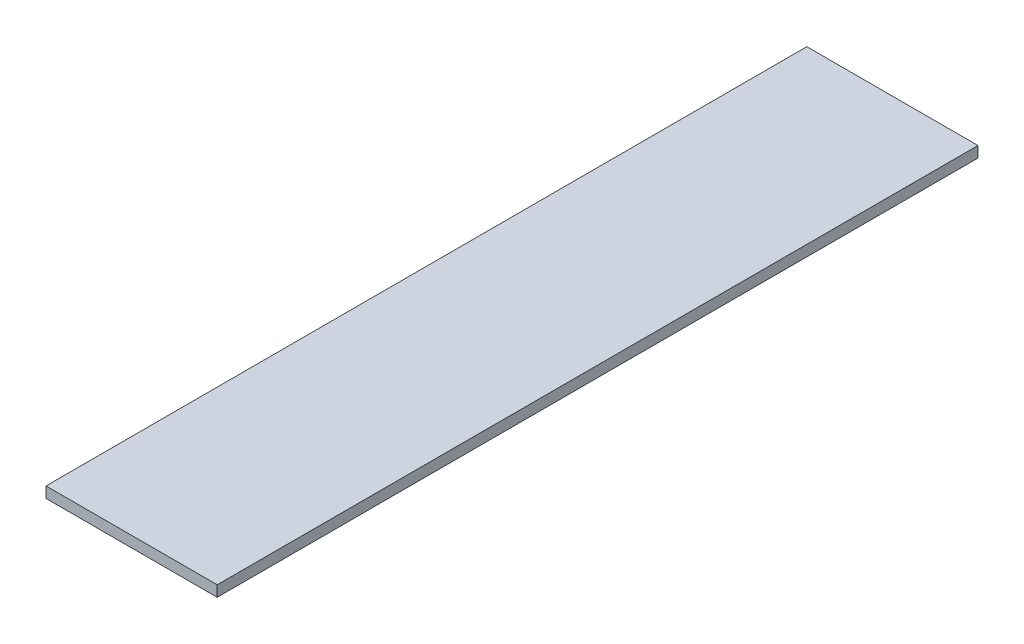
SolidWorks part; units mm, degrees
ref_plane "Front Plane" through (0, 0, 0) normal (0, 0, 1) x (1, 0, 0)
ref_plane "Top Plane" through (0, 0, 0) normal (0, 1, 0) x (1, 0, 0)
ref_plane "Right Plane" through (0, 0, 0) normal (1, 0, 0) x (0, 0, -1)
sketch "Sketch1" plane through (0, 0, 0) normal (0, 1, 0) x (1, 0, 0)
  line L1 (-100.0125, 444.5) -> (100.0125, 444.5)
  line L2 (-100.0125, 444.5) -> (-100.0125, -444.5)
  line L3 (-100.0125, -444.5) -> (100.0125, -444.5)
  line L4 (100.0125, 444.5) -> (100.0125, -444.5)
  line L5 (-100.0125, 444.5) -> (100.0125, -444.5) construction
  line L6 (-100.0125, -444.5) -> (100.0125, 444.5) construction
  point P0 (0, 0)
  dimension "D1" = 200.025
  dimension "D2" = 889
extrude "Boss-Extrude1" add sketch "Sketch1" along normal mid plane 12.7
